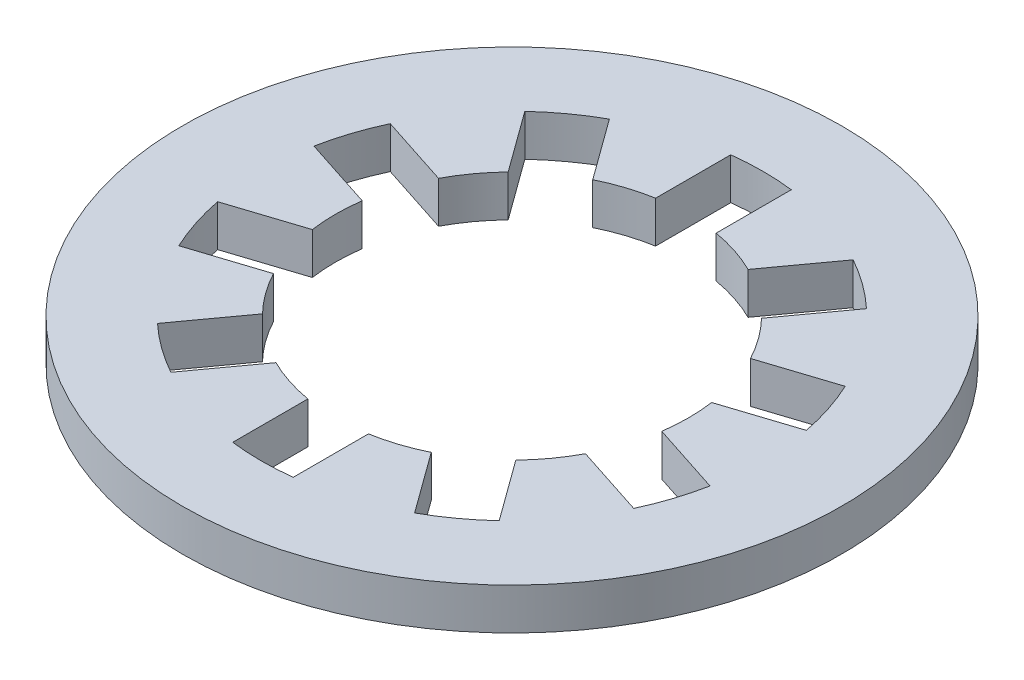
SolidWorks part; units mm, degrees
ref_plane "Front Plane" through (0, 0, 0) normal (0, 0, 1) x (1, 0, 0)
ref_plane "Top Plane" through (0, 0, 0) normal (0, 1, 0) x (1, 0, 0)
ref_plane "Right Plane" through (0, 0, 0) normal (1, 0, 0) x (0, 0, -1)
sketch "Sketch1" plane through (0, 0, 0) normal (0, 1, 0) x (1, 0, 0)
  circle A0 centre (0, 0) radius 4.8387
extrude "Boss-Extrude1" add sketch "Sketch1" along normal blind 0.6096
sketch "Sketch2" plane through (0, 0.6096, 0) normal (0, 1, 0) x (1, 0, 0)
  line L0 (1.1406, 2.3262) -> (1.7894, 3.2191)
  line L1 (1.8599, 1.8037) -> (2.5086, 2.6966)
  line L2 (2.2901, 1.2115) -> (3.3398, 1.5525)
  line L3 (-0.4445, 2.5524) -> (-0.4445, 3.6561)
  line L4 (2.5648, 0.366) -> (3.6145, 0.707)
  line L5 (0.4445, 2.5524) -> (0.4445, 3.6561)
  line L6 (2.5648, -0.366) -> (3.6145, -0.707)
  line L7 (2.2901, -1.2115) -> (3.3398, -1.5525)
  line L8 (1.8599, -1.8037) -> (2.5086, -2.6966)
  line L9 (1.1406, -2.3262) -> (1.7894, -3.2191)
  line L10 (0.4445, -2.5524) -> (0.4445, -3.6561)
  line L11 (-0.4445, -2.5524) -> (-0.4445, -3.6561)
  line L12 (-1.1406, -2.3262) -> (-1.7894, -3.2191)
  line L13 (-1.8599, -1.8037) -> (-2.5086, -2.6966)
  line L14 (-2.2901, -1.2115) -> (-3.3398, -1.5525)
  line L15 (-2.5648, -0.366) -> (-3.6145, -0.707)
  line L16 (-2.5648, 0.366) -> (-3.6145, 0.707)
  line L17 (-2.2901, 1.2115) -> (-3.3398, 1.5525)
  line L18 (-1.8599, 1.8037) -> (-2.5086, 2.6966)
  line L19 (-1.1406, 2.3262) -> (-1.7894, 3.2191)
  arc A0 (0.4445, 2.5524) -> (-0.4445, 2.5524) centre (0, 0) ccw
  arc A1 (0.4445, 3.6561) -> (-0.4445, 3.6561) centre (0, 0) ccw
  arc A2 (1.8599, 1.8037) -> (1.1406, 2.3262) centre (0, 0) ccw
  arc A3 (2.5086, 2.6966) -> (1.7894, 3.2191) centre (0, 0) ccw
  arc A4 (2.5648, 0.366) -> (2.2901, 1.2115) centre (0, 0) ccw
  arc A5 (3.6145, 0.707) -> (3.3398, 1.5525) centre (0, 0) ccw
  arc A6 (2.2901, -1.2115) -> (2.5648, -0.366) centre (0, 0) ccw
  arc A7 (3.3398, -1.5525) -> (3.6145, -0.707) centre (0, 0) ccw
  arc A8 (1.1406, -2.3262) -> (1.8599, -1.8037) centre (0, 0) ccw
  arc A9 (1.7894, -3.2191) -> (2.5086, -2.6966) centre (0, 0) ccw
  arc A10 (-0.4445, -2.5524) -> (0.4445, -2.5524) centre (0, 0) ccw
  arc A11 (-0.4445, -3.6561) -> (0.4445, -3.6561) centre (0, 0) ccw
  arc A12 (-1.8599, -1.8037) -> (-1.1406, -2.3262) centre (0, 0) ccw
  arc A13 (-2.5086, -2.6966) -> (-1.7894, -3.2191) centre (0, 0) ccw
  arc A14 (-2.5648, -0.366) -> (-2.2901, -1.2115) centre (0, 0) ccw
  arc A15 (-3.6145, -0.707) -> (-3.3398, -1.5525) centre (0, 0) ccw
  arc A16 (-2.2901, 1.2115) -> (-2.5648, 0.366) centre (0, 0) ccw
  arc A17 (-3.3398, 1.5525) -> (-3.6145, 0.707) centre (0, 0) ccw
  arc A18 (-1.1406, 2.3262) -> (-1.8599, 1.8037) centre (0, 0) ccw
  arc A19 (-1.7894, 3.2191) -> (-2.5086, 2.6966) centre (0, 0) ccw
  point P1 (0, 0)
  point P3 (0, 0)
  point P5 (0, 0)
  point P6 (0, 0)
  point P48 (0, 0)
  dimension "D1" = 10
extrude "Cut-Extrude1" cut sketch "Sketch2" against normal through all
sketch "Sketch3" plane through (0, 0.6096, 0) normal (0, 1, 0) x (1, 0, 0)
  circle A0 centre (0, 0) radius 2.5908
extrude "Cut-Extrude2" cut sketch "Sketch3" against normal blind 2.54
